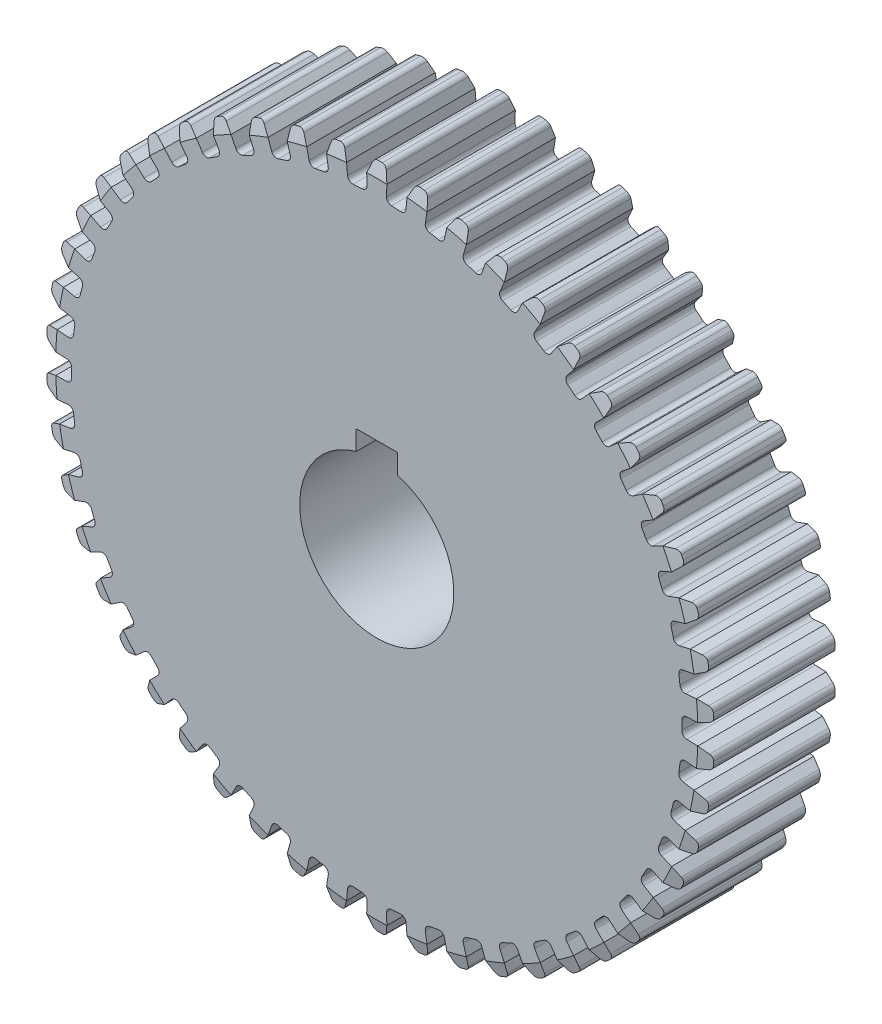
SolidWorks part; units mm, degrees
ref_plane "Front X-Y" through (0, 0, 0) normal (0, 0, 1) x (1, 0, 0)
ref_plane "Top X-Z" through (0, 0, 0) normal (0, 1, 0) x (1, 0, 0)
ref_plane "Right Y-Z" through (0, 0, 0) normal (1, 0, 0) x (0, 0, -1)
ref_plane "Plane1" through (0, 0, 0) normal (1, 0, 0) x (0, 0, -1)
sketch "Sketch1" plane through (0, 0, 0) normal (1, 0, 0) x (0, 0, -1)
  line L0 (-34, 15.3) -> (-33.7, 15)
  line L1 (-33.7, 15) -> (-0.3, 15)
  line L2 (-0.3, 15) -> (0, 15.3)
  line L3 (0, 15.3) -> (0, 62.5)
  line L4 (0, 62.5) -> (-1.2058, 67)
  line L5 (-1.2058, 67) -> (-23.7942, 67)
  line L6 (-23.7942, 67) -> (-25, 62.5)
  line L7 (-25, 62.5) -> (-25, 22)
  line L8 (-25, 22) -> (-33.5, 22)
  line L9 (-33.5, 22) -> (-34, 21.5)
  line L10 (-34, 21.5) -> (-34, 15.3)
  line L11 (0, 0) -> (-34, 0) construction
revolve "Revolve1" add sketch "Sketch1" angle 360 about L11
ref_plane "Plane2" through (0, 0, 0) normal (0, 0, 1) x (1, 0, 0)
sketch "Sketch2" plane through (0, 0, 0) normal (0, 0, 1) x (1, 0, 0)
  line L0 (-64.0989, -5.393) -> (-62.2226, -5.8818)
  line L1 (-62.2226, -5.8818) -> (-60.0988, -5.681)
  line L2 (-59.6235, -9.4434) -> (-61.7305, -9.7772)
  line L3 (-61.7305, -9.7772) -> (-63.4263, -10.7171)
  line L4 (-62.9175, -13.3842) -> (-60.9948, -13.634)
  line L5 (-60.9948, -13.634) -> (-58.9129, -13.1686)
  line L6 (-57.9698, -16.8418) -> (-60.0184, -17.4369)
  line L7 (-60.0184, -17.4369) -> (-61.583, -18.5821)
  line L8 (-60.7439, -21.1644) -> (-58.805, -21.1711)
  line L9 (-58.805, -21.1711) -> (-56.7979, -20.4485)
  line L10 (-55.4018, -23.9745) -> (-57.3597, -24.8217)
  line L11 (-57.3597, -24.8217) -> (-58.7684, -26.1539)
  line L12 (-57.6123, -28.6107) -> (-55.6879, -28.3744)
  line L13 (-55.6879, -28.3744) -> (-53.7871, -27.4059)
  line L14 (-51.9602, -30.7292) -> (-53.7964, -31.8151)
  line L15 (-53.7964, -31.8151) -> (-55.027, -33.3133)
  line L16 (-53.5722, -35.6058) -> (-51.6925, -35.1302)
  line L17 (-51.6925, -35.1302) -> (-49.9281, -33.9311)
  line L18 (-47.6991, -36.9992) -> (-49.3847, -38.3067)
  line L19 (-49.3847, -38.3067) -> (-50.4179, -39.9474)
  line L20 (-48.6871, -42.0394) -> (-46.8819, -41.332)
  line L21 (-46.8819, -41.332) -> (-45.2817, -39.9212)
  line L22 (-42.6857, -42.6857) -> (-44.1942, -44.1942)
  line L23 (-44.1942, -44.1942) -> (-45.0136, -45.9514)
  line L24 (-43.0343, -47.8101) -> (-41.332, -46.8819)
  line L25 (-41.332, -46.8819) -> (-39.9212, -45.2817)
  line L26 (-36.9992, -47.6991) -> (-38.3067, -49.3847)
  line L27 (-38.3067, -49.3847) -> (-38.8994, -51.2307)
  line L28 (-36.7028, -52.8267) -> (-35.1302, -51.6925)
  line L29 (-35.1302, -51.6925) -> (-33.9311, -49.9281)
  line L30 (-30.7292, -51.9602) -> (-31.8151, -53.7964)
  line L31 (-31.8151, -53.7964) -> (-32.1717, -55.7022)
  line L32 (-29.7924, -57.0102) -> (-28.3744, -55.6879)
  line L33 (-28.3744, -55.6879) -> (-27.4059, -53.7871)
  line L34 (-23.9745, -55.4018) -> (-24.8217, -57.3597)
  line L35 (-24.8217, -57.3597) -> (-24.9367, -59.2951)
  line L36 (-22.4122, -60.2947) -> (-21.1711, -58.805)
  line L37 (-21.1711, -58.805) -> (-20.4485, -56.7979)
  line L38 (-16.8418, -57.9698) -> (-17.4369, -60.0184)
  line L39 (-17.4369, -60.0184) -> (-17.3084, -61.953)
  line L40 (-14.6786, -62.6282) -> (-13.634, -60.9948)
  line L41 (-13.634, -60.9948) -> (-13.1686, -58.9129)
  line L42 (-9.4434, -59.6235) -> (-9.7772, -61.7305)
  line L43 (-9.7772, -61.7305) -> (-9.4072, -63.6338)
  line L44 (-6.7134, -63.9741) -> (-5.8818, -62.2226)
  line L45 (-5.8818, -62.2226) -> (-5.681, -60.0988)
  line L46 (-1.8962, -60.3369) -> (-1.9632, -62.4692)
  line L47 (-1.9632, -62.4692) -> (-1.3576, -64.311)
  line L48 (1.3576, -64.311) -> (1.9632, -62.4692)
  line L49 (1.9632, -62.4692) -> (1.8962, -60.3369)
  line L50 (5.681, -60.0988) -> (5.8818, -62.2226)
  line L51 (5.8818, -62.2226) -> (6.7134, -63.9741)
  line L52 (9.4072, -63.6338) -> (9.7772, -61.7305)
  line L53 (9.7772, -61.7305) -> (9.4434, -59.6235)
  line L54 (13.1686, -58.9129) -> (13.634, -60.9948)
  line L55 (13.634, -60.9948) -> (14.6786, -62.6282)
  line L56 (17.3084, -61.953) -> (17.4369, -60.0184)
  line L57 (17.4369, -60.0184) -> (16.8418, -57.9698)
  line L58 (20.4485, -56.7979) -> (21.1711, -58.805)
  line L59 (21.1711, -58.805) -> (22.4122, -60.2947)
  line L60 (24.9367, -59.2951) -> (24.8217, -57.3597)
  line L61 (24.8217, -57.3597) -> (23.9745, -55.4018)
  line L62 (27.4059, -53.7871) -> (28.3744, -55.6879)
  line L63 (28.3744, -55.6879) -> (29.7924, -57.0102)
  line L64 (32.1717, -55.7022) -> (31.8151, -53.7964)
  line L65 (31.8151, -53.7964) -> (30.7292, -51.9602)
  line L66 (33.9311, -49.9281) -> (35.1302, -51.6925)
  line L67 (35.1302, -51.6925) -> (36.7028, -52.8267)
  line L68 (38.8994, -51.2307) -> (38.3067, -49.3847)
  line L69 (38.3067, -49.3847) -> (36.9992, -47.6991)
  line L70 (39.9212, -45.2817) -> (41.332, -46.8819)
  line L71 (41.332, -46.8819) -> (43.0343, -47.8101)
  line L72 (45.0136, -45.9514) -> (44.1942, -44.1942)
  line L73 (44.1942, -44.1942) -> (42.6857, -42.6857)
  line L74 (45.2817, -39.9212) -> (46.8819, -41.332)
  line L75 (46.8819, -41.332) -> (48.6871, -42.0394)
  line L76 (50.4179, -39.9474) -> (49.3847, -38.3067)
  line L77 (49.3847, -38.3067) -> (47.6991, -36.9992)
  line L78 (49.9281, -33.9311) -> (51.6925, -35.1302)
  line L79 (51.6925, -35.1302) -> (53.5722, -35.6058)
  line L80 (55.027, -33.3133) -> (53.7964, -31.8151)
  line L81 (53.7964, -31.8151) -> (51.9602, -30.7292)
  line L82 (53.7871, -27.4059) -> (55.6879, -28.3744)
  line L83 (55.6879, -28.3744) -> (57.6123, -28.6107)
  line L84 (58.7684, -26.1539) -> (57.3597, -24.8217)
  line L85 (57.3597, -24.8217) -> (55.4018, -23.9745)
  line L86 (56.7979, -20.4485) -> (58.805, -21.1711)
  line L87 (58.805, -21.1711) -> (60.7439, -21.1644)
  line L88 (61.583, -18.5821) -> (60.0184, -17.4369)
  line L89 (60.0184, -17.4369) -> (57.9698, -16.8418)
  line L90 (58.9129, -13.1686) -> (60.9948, -13.634)
  line L91 (60.9948, -13.634) -> (62.9175, -13.3842)
  line L92 (63.4263, -10.7171) -> (61.7305, -9.7772)
  line L93 (61.7305, -9.7772) -> (59.6235, -9.4434)
  line L94 (60.0988, -5.681) -> (62.2226, -5.8818)
  line L95 (62.2226, -5.8818) -> (64.0989, -5.393)
  line L96 (64.2694, -2.6832) -> (62.4692, -1.9632)
  line L97 (62.4692, -1.9632) -> (60.3369, -1.8962)
  line L98 (60.3369, 1.8962) -> (62.4692, 1.9632)
  line L99 (62.4692, 1.9632) -> (64.2694, 2.6832)
  line L100 (64.0989, 5.393) -> (62.2226, 5.8818)
  line L101 (62.2226, 5.8818) -> (60.0988, 5.681)
  line L102 (59.6235, 9.4434) -> (61.7305, 9.7772)
  line L103 (61.7305, 9.7772) -> (63.4263, 10.7171)
  line L104 (62.9175, 13.3842) -> (60.9948, 13.634)
  line L105 (60.9948, 13.634) -> (58.9129, 13.1686)
  line L106 (57.9698, 16.8418) -> (60.0184, 17.4369)
  line L107 (60.0184, 17.4369) -> (61.583, 18.5821)
  line L108 (60.7439, 21.1644) -> (58.805, 21.1711)
  line L109 (58.805, 21.1711) -> (56.7979, 20.4485)
  line L110 (55.4018, 23.9745) -> (57.3597, 24.8217)
  line L111 (57.3597, 24.8217) -> (58.7684, 26.1539)
  line L112 (57.6123, 28.6107) -> (55.6879, 28.3744)
  line L113 (55.6879, 28.3744) -> (53.7871, 27.4059)
  line L114 (51.9602, 30.7292) -> (53.7964, 31.8151)
  line L115 (53.7964, 31.8151) -> (55.027, 33.3133)
  line L116 (53.5722, 35.6058) -> (51.6925, 35.1302)
  line L117 (51.6925, 35.1302) -> (49.9281, 33.9311)
  line L118 (47.6991, 36.9992) -> (49.3847, 38.3067)
  line L119 (49.3847, 38.3067) -> (50.4179, 39.9474)
  line L120 (48.6871, 42.0394) -> (46.8819, 41.332)
  line L121 (46.8819, 41.332) -> (45.2817, 39.9212)
  line L122 (42.6857, 42.6857) -> (44.1942, 44.1942)
  line L123 (44.1942, 44.1942) -> (45.0136, 45.9514)
  line L124 (43.0343, 47.8101) -> (41.332, 46.8819)
  line L125 (41.332, 46.8819) -> (39.9212, 45.2817)
  line L126 (36.9992, 47.6991) -> (38.3067, 49.3847)
  line L127 (38.3067, 49.3847) -> (38.8994, 51.2307)
  line L128 (36.7028, 52.8267) -> (35.1302, 51.6925)
  line L129 (35.1302, 51.6925) -> (33.9311, 49.9281)
  line L130 (30.7292, 51.9602) -> (31.8151, 53.7964)
  line L131 (31.8151, 53.7964) -> (32.1717, 55.7022)
  line L132 (29.7924, 57.0102) -> (28.3744, 55.6879)
  line L133 (28.3744, 55.6879) -> (27.4059, 53.7871)
  line L134 (23.9745, 55.4018) -> (24.8217, 57.3597)
  line L135 (24.8217, 57.3597) -> (24.9367, 59.2951)
  line L136 (22.4122, 60.2947) -> (21.1711, 58.805)
  line L137 (21.1711, 58.805) -> (20.4485, 56.7979)
  line L138 (16.8418, 57.9698) -> (17.4369, 60.0184)
  line L139 (17.4369, 60.0184) -> (17.3084, 61.953)
  line L140 (14.6786, 62.6282) -> (13.634, 60.9948)
  line L141 (13.634, 60.9948) -> (13.1686, 58.9129)
  line L142 (9.4434, 59.6235) -> (9.7772, 61.7305)
  line L143 (9.7772, 61.7305) -> (9.4072, 63.6338)
  line L144 (6.7134, 63.9741) -> (5.8818, 62.2226)
  line L145 (5.8818, 62.2226) -> (5.681, 60.0988)
  line L146 (1.8962, 60.3369) -> (1.9632, 62.4692)
  line L147 (1.9632, 62.4692) -> (1.3576, 64.311)
  line L148 (-1.3576, 64.311) -> (-1.9632, 62.4692)
  line L149 (-1.9632, 62.4692) -> (-1.8962, 60.3369)
  line L150 (-5.681, 60.0988) -> (-5.8818, 62.2226)
  line L151 (-5.8818, 62.2226) -> (-6.7134, 63.9741)
  line L152 (-9.4072, 63.6338) -> (-9.7772, 61.7305)
  line L153 (-9.7772, 61.7305) -> (-9.4434, 59.6235)
  line L154 (-13.1686, 58.9129) -> (-13.634, 60.9948)
  line L155 (-13.634, 60.9948) -> (-14.6786, 62.6282)
  line L156 (-17.3084, 61.953) -> (-17.4369, 60.0184)
  line L157 (-17.4369, 60.0184) -> (-16.8418, 57.9698)
  line L158 (-20.4485, 56.7979) -> (-21.1711, 58.805)
  line L159 (-21.1711, 58.805) -> (-22.4122, 60.2947)
  line L160 (-24.9367, 59.2951) -> (-24.8217, 57.3597)
  line L161 (-24.8217, 57.3597) -> (-23.9745, 55.4018)
  line L162 (-27.4059, 53.7871) -> (-28.3744, 55.6879)
  line L163 (-28.3744, 55.6879) -> (-29.7924, 57.0102)
  line L164 (-32.1717, 55.7022) -> (-31.8151, 53.7964)
  line L165 (-31.8151, 53.7964) -> (-30.7292, 51.9602)
  line L166 (-33.9311, 49.9281) -> (-35.1302, 51.6925)
  line L167 (-35.1302, 51.6925) -> (-36.7028, 52.8267)
  line L168 (-38.8994, 51.2307) -> (-38.3067, 49.3847)
  line L169 (-38.3067, 49.3847) -> (-36.9992, 47.6991)
  line L170 (-39.9212, 45.2817) -> (-41.332, 46.8819)
  line L171 (-41.332, 46.8819) -> (-43.0343, 47.8101)
  line L172 (-45.0136, 45.9514) -> (-44.1942, 44.1942)
  line L173 (-44.1942, 44.1942) -> (-42.6857, 42.6857)
  line L174 (-45.2817, 39.9212) -> (-46.8819, 41.332)
  line L175 (-46.8819, 41.332) -> (-48.6871, 42.0394)
  line L176 (-50.4179, 39.9474) -> (-49.3847, 38.3067)
  line L177 (-49.3847, 38.3067) -> (-47.6991, 36.9992)
  line L178 (-49.9281, 33.9311) -> (-51.6925, 35.1302)
  line L179 (-51.6925, 35.1302) -> (-53.5722, 35.6058)
  line L180 (-55.027, 33.3133) -> (-53.7964, 31.8151)
  line L181 (-53.7964, 31.8151) -> (-51.9602, 30.7292)
  line L182 (-53.7871, 27.4059) -> (-55.6879, 28.3744)
  line L183 (-55.6879, 28.3744) -> (-57.6123, 28.6107)
  line L184 (-58.7684, 26.1539) -> (-57.3597, 24.8217)
  line L185 (-57.3597, 24.8217) -> (-55.4018, 23.9745)
  line L186 (-56.7979, 20.4485) -> (-58.805, 21.1711)
  line L187 (-58.805, 21.1711) -> (-60.7439, 21.1644)
  line L188 (-61.583, 18.5821) -> (-60.0184, 17.4369)
  line L189 (-60.0184, 17.4369) -> (-57.9698, 16.8418)
  line L190 (-58.9129, 13.1686) -> (-60.9948, 13.634)
  line L191 (-60.9948, 13.634) -> (-62.9175, 13.3842)
  line L192 (-63.4263, 10.7171) -> (-61.7305, 9.7772)
  line L193 (-61.7305, 9.7772) -> (-59.6235, 9.4434)
  line L194 (-60.0988, 5.681) -> (-62.2226, 5.8818)
  line L195 (-62.2226, 5.8818) -> (-64.0989, 5.393)
  line L196 (-64.2694, 2.6832) -> (-62.4692, 1.9632)
  line L197 (-62.4692, 1.9632) -> (-60.3369, 1.8962)
  line L198 (-60.3369, -1.8962) -> (-62.4692, -1.9632)
  line L199 (-62.4692, -1.9632) -> (-64.2694, -2.6832)
  circle A0 centre (0, 0) radius 70
  arc A1 (-64.2694, -2.6832) -> (-64.8964, -3.6681) centre (-63.898, -3.6117) ccw
  arc A2 (-64.8964, -3.6681) -> (-64.8444, -4.4945) centre (0, 0) ccw
  arc A3 (-64.8444, -4.4945) -> (-64.0989, -5.393) centre (-63.8468, -4.4253) ccw
  arc A4 (-60.0988, -5.681) -> (-59.0108, -6.566) centre (-60.0047, -6.6766) cw
  arc A5 (-59.0108, -6.566) -> (-58.7898, -8.3157) centre (0, 0) ccw
  arc A6 (-58.7898, -8.3157) -> (-59.6235, -9.4434) centre (-59.7799, -8.4557) cw
  arc A7 (-63.4263, -10.7171) -> (-63.925, -11.7729) centre (-62.9415, -11.5918) ccw
  arc A8 (-63.925, -11.7729) -> (-63.7698, -12.5862) centre (0, 0) ccw
  arc A9 (-63.7698, -12.5862) -> (-62.9175, -13.3842) centre (-62.7887, -12.3926) ccw
  arc A10 (-58.9129, -13.1686) -> (-57.7226, -13.9102) centre (-58.6947, -14.1445) cw
  arc A11 (-57.7226, -13.9102) -> (-57.284, -15.6184) centre (0, 0) ccw
  arc A12 (-57.284, -15.6184) -> (-57.9698, -16.8418) centre (-58.2488, -15.8815) cw
  arc A13 (-61.583, -18.5821) -> (-61.9454, -19.692) centre (-60.9923, -19.389) ccw
  arc A14 (-61.9454, -19.692) -> (-61.6895, -20.4794) centre (0, 0) ccw
  arc A15 (-61.6895, -20.4794) -> (-60.7439, -21.1644) centre (-60.7404, -20.1644) ccw
  arc A16 (-56.7979, -20.4485) -> (-55.524, -21.0351) centre (-56.4591, -21.3894) cw
  arc A17 (-55.524, -21.0351) -> (-54.8748, -22.6749) centre (0, 0) ccw
  arc A18 (-54.8748, -22.6749) -> (-55.4018, -23.9745) centre (-55.799, -23.0568) cw
  arc A19 (-58.7684, -26.1539) -> (-58.9888, -27.3005) centre (-58.0813, -26.8805) ccw
  arc A20 (-58.9888, -27.3005) -> (-58.6363, -28.0497) centre (0, 0) ccw
  arc A21 (-58.6363, -28.0497) -> (-57.6123, -28.6107) centre (-57.7342, -27.6181) ccw
  arc A22 (-53.7871, -27.4059) -> (-52.4498, -27.8282) centre (-53.3331, -28.2969) cw
  arc A23 (-52.4498, -27.8282) -> (-51.6002, -29.3737) centre (0, 0) ccw
  arc A24 (-51.6002, -29.3737) -> (-51.9602, -30.7292) centre (-52.4692, -29.8684) cw
  arc A25 (-55.027, -33.3133) -> (-55.102, -34.4785) centre (-54.2543, -33.9481) ccw
  arc A26 (-55.102, -34.4785) -> (-54.6584, -35.1776) centre (0, 0) ccw
  arc A27 (-54.6584, -35.1776) -> (-53.5722, -35.6058) centre (-53.8175, -34.6364) ccw
  arc A28 (-49.9281, -33.9311) -> (-48.5484, -34.1825) centre (-49.3661, -34.7582) cw
  arc A29 (-48.5484, -34.1825) -> (-47.5118, -35.6093) centre (0, 0) ccw
  arc A30 (-47.5118, -35.6093) -> (-47.6991, -36.9992) centre (-48.312, -36.209) cw
  arc A31 (-50.4179, -39.9474) -> (-50.3462, -41.1127) centre (-49.5717, -40.4802) ccw
  arc A32 (-50.3462, -41.1127) -> (-49.8185, -41.7507) centre (0, 0) ccw
  arc A33 (-49.8185, -41.7507) -> (-48.6871, -42.0394) centre (-49.052, -41.1084) ccw
  arc A34 (-45.2817, -39.9212) -> (-43.8814, -39.9977) centre (-44.6204, -40.6713) cw
  arc A35 (-43.8814, -39.9977) -> (-42.6741, -41.2833) centre (0, 0) ccw
  arc A36 (-42.6741, -41.2833) -> (-42.6857, -42.6857) centre (-43.3928, -41.9786) cw
  arc A37 (-45.0136, -45.9514) -> (-44.7964, -47.0986) centre (-44.1073, -46.374) ccw
  arc A38 (-44.7964, -47.0986) -> (-44.1929, -47.6654) centre (0, 0) ccw
  arc A39 (-44.1929, -47.6654) -> (-43.0343, -47.8101) centre (-43.513, -46.9321) ccw
  arc A40 (-39.9212, -45.2817) -> (-38.5223, -45.1821) centre (-39.1711, -45.9431) cw
  arc A41 (-38.5223, -45.1821) -> (-37.1634, -46.3063) centre (0, 0) ccw
  arc A42 (-37.1634, -46.3063) -> (-36.9992, -47.6991) centre (-37.7893, -47.0862) cw
  arc A43 (-38.8994, -51.2307) -> (-38.5402, -52.3417) centre (-37.9473, -51.5364) ccw
  arc A44 (-38.5402, -52.3417) -> (-37.8703, -52.8284) centre (0, 0) ccw
  arc A45 (-37.8703, -52.8284) -> (-36.7028, -52.8267) centre (-37.2877, -52.0156) ccw
  arc A46 (-33.9311, -49.9281) -> (-32.5557, -49.6539) centre (-33.104, -50.4902) cw
  arc A47 (-32.5557, -49.6539) -> (-31.0667, -50.5989) centre (0, 0) ccw
  arc A48 (-31.0667, -50.5989) -> (-30.7292, -51.9602) centre (-31.5899, -51.4511) cw
  arc A49 (-32.1717, -55.7022) -> (-31.6761, -56.7593) centre (-31.1888, -55.8861) ccw
  arc A50 (-31.6761, -56.7593) -> (-30.9506, -57.1582) centre (0, 0) ccw
  arc A51 (-30.9506, -57.1582) -> (-29.7924, -57.0102) centre (-30.4744, -56.2789) ccw
  arc A52 (-27.4059, -53.7871) -> (-26.0757, -53.3427) centre (-26.5149, -54.2411) cw
  arc A53 (-26.0757, -53.3427) -> (-24.48, -54.0936) centre (0, 0) ccw
  arc A54 (-24.48, -54.0936) -> (-23.9745, -55.4018) centre (-24.8923, -55.0047) cw
  arc A55 (-24.9367, -59.2951) -> (-24.3125, -60.2818) centre (-23.9385, -59.3544) ccw
  arc A56 (-24.3125, -60.2818) -> (-23.5427, -60.5866) centre (0, 0) ccw
  arc A57 (-23.5427, -60.5866) -> (-22.4122, -60.2947) centre (-23.1805, -59.6545) ccw
  arc A58 (-20.4485, -56.7979) -> (-19.1845, -56.1903) centre (-19.5076, -57.1366) cw
  arc A59 (-19.1845, -56.1903) -> (-17.5072, -56.7352) centre (0, 0) ccw
  arc A60 (-17.5072, -56.7352) -> (-16.8418, -57.9698) centre (-17.8021, -57.6908) cw
  arc A61 (-17.3084, -61.953) -> (-16.5655, -62.8537) centre (-16.3106, -61.8867) ccw
  arc A62 (-16.5655, -62.8537) -> (-15.7635, -63.0596) centre (0, 0) ccw
  arc A63 (-15.7635, -63.0596) -> (-14.6786, -62.6282) centre (-15.521, -62.0894) ccw
  arc A64 (-13.1686, -58.9129) -> (-11.9907, -58.1516) centre (-12.1927, -59.131) cw
  arc A65 (-11.9907, -58.1516) -> (-10.2584, -58.4821) centre (0, 0) ccw
  arc A66 (-10.2584, -58.4821) -> (-9.4434, -59.6235) centre (-10.4311, -59.4671) cw
  arc A67 (-9.4072, -63.6338) -> (-8.5572, -64.4343) centre (-8.4256, -63.443) ccw
  arc A68 (-8.5572, -64.4343) -> (-7.7358, -64.538) centre (0, 0) ccw
  arc A69 (-7.7358, -64.538) -> (-6.7134, -63.9741) centre (-7.6168, -63.5451) ccw
  arc A70 (-5.681, -60.0988) -> (-4.6078, -59.1959) centre (-4.6854, -60.1929) cw
  arc A71 (-4.6078, -59.1959) -> (-2.8477, -59.3067) centre (0, 0) ccw
  arc A72 (-2.8477, -59.3067) -> (-1.8962, -60.3369) centre (-2.8957, -60.3055) cw
  arc A73 (-1.3576, -64.311) -> (-0.414, -64.9987) centre (-0.4076, -63.9987) ccw
  arc A74 (-0.414, -64.9987) -> (0.414, -64.9987) centre (0, 0) ccw
  arc A75 (0.414, -64.9987) -> (1.3576, -64.311) centre (0.4076, -63.9987) ccw
  arc A76 (1.8962, -60.3369) -> (2.8477, -59.3067) centre (2.8957, -60.3055) cw
  arc A77 (2.8477, -59.3067) -> (4.6078, -59.1959) centre (0, 0) ccw
  arc A78 (4.6078, -59.1959) -> (5.681, -60.0988) centre (4.6854, -60.1929) cw
  arc A79 (6.7134, -63.9741) -> (7.7358, -64.538) centre (7.6168, -63.5451) ccw
  arc A80 (7.7358, -64.538) -> (8.5572, -64.4343) centre (0, 0) ccw
  arc A81 (8.5572, -64.4343) -> (9.4072, -63.6338) centre (8.4256, -63.443) ccw
  arc A82 (9.4434, -59.6235) -> (10.2584, -58.4821) centre (10.4311, -59.4671) cw
  arc A83 (10.2584, -58.4821) -> (11.9907, -58.1516) centre (0, 0) ccw
  arc A84 (11.9907, -58.1516) -> (13.1686, -58.9129) centre (12.1927, -59.131) cw
  arc A85 (14.6786, -62.6282) -> (15.7635, -63.0596) centre (15.521, -62.0894) ccw
  arc A86 (15.7635, -63.0596) -> (16.5655, -62.8537) centre (0, 0) ccw
  arc A87 (16.5655, -62.8537) -> (17.3084, -61.953) centre (16.3106, -61.8867) ccw
  arc A88 (16.8418, -57.9698) -> (17.5072, -56.7352) centre (17.8021, -57.6908) cw
  arc A89 (17.5072, -56.7352) -> (19.1845, -56.1903) centre (0, 0) ccw
  arc A90 (19.1845, -56.1903) -> (20.4485, -56.7979) centre (19.5076, -57.1366) cw
  arc A91 (22.4122, -60.2947) -> (23.5427, -60.5866) centre (23.1805, -59.6545) ccw
  arc A92 (23.5427, -60.5866) -> (24.3125, -60.2818) centre (0, 0) ccw
  arc A93 (24.3125, -60.2818) -> (24.9367, -59.2951) centre (23.9385, -59.3544) ccw
  arc A94 (23.9745, -55.4018) -> (24.48, -54.0936) centre (24.8923, -55.0047) cw
  arc A95 (24.48, -54.0936) -> (26.0757, -53.3427) centre (0, 0) ccw
  arc A96 (26.0757, -53.3427) -> (27.4059, -53.7871) centre (26.5149, -54.2411) cw
  arc A97 (29.7924, -57.0102) -> (30.9506, -57.1582) centre (30.4744, -56.2789) ccw
  arc A98 (30.9506, -57.1582) -> (31.6761, -56.7593) centre (0, 0) ccw
  arc A99 (31.6761, -56.7593) -> (32.1717, -55.7022) centre (31.1888, -55.8861) ccw
  arc A100 (30.7292, -51.9602) -> (31.0667, -50.5989) centre (31.5899, -51.4511) cw
  arc A101 (31.0667, -50.5989) -> (32.5557, -49.6539) centre (0, 0) ccw
  arc A102 (32.5557, -49.6539) -> (33.9311, -49.9281) centre (33.104, -50.4902) cw
  arc A103 (36.7028, -52.8267) -> (37.8703, -52.8284) centre (37.2877, -52.0156) ccw
  arc A104 (37.8703, -52.8284) -> (38.5402, -52.3417) centre (0, 0) ccw
  arc A105 (38.5402, -52.3417) -> (38.8994, -51.2307) centre (37.9473, -51.5364) ccw
  arc A106 (36.9992, -47.6991) -> (37.1634, -46.3063) centre (37.7893, -47.0862) cw
  arc A107 (37.1634, -46.3063) -> (38.5223, -45.1821) centre (0, 0) ccw
  arc A108 (38.5223, -45.1821) -> (39.9212, -45.2817) centre (39.1711, -45.9431) cw
  arc A109 (43.0343, -47.8101) -> (44.1929, -47.6654) centre (43.513, -46.9321) ccw
  arc A110 (44.1929, -47.6654) -> (44.7964, -47.0986) centre (0, 0) ccw
  arc A111 (44.7964, -47.0986) -> (45.0136, -45.9514) centre (44.1073, -46.374) ccw
  arc A112 (42.6857, -42.6857) -> (42.6741, -41.2833) centre (43.3928, -41.9786) cw
  arc A113 (42.6741, -41.2833) -> (43.8814, -39.9977) centre (0, 0) ccw
  arc A114 (43.8814, -39.9977) -> (45.2817, -39.9212) centre (44.6204, -40.6713) cw
  arc A115 (48.6871, -42.0394) -> (49.8185, -41.7507) centre (49.052, -41.1084) ccw
  arc A116 (49.8185, -41.7507) -> (50.3462, -41.1127) centre (0, 0) ccw
  arc A117 (50.3462, -41.1127) -> (50.4179, -39.9474) centre (49.5717, -40.4802) ccw
  arc A118 (47.6991, -36.9992) -> (47.5118, -35.6093) centre (48.312, -36.209) cw
  arc A119 (47.5118, -35.6093) -> (48.5484, -34.1825) centre (0, 0) ccw
  arc A120 (48.5484, -34.1825) -> (49.9281, -33.9311) centre (49.3661, -34.7582) cw
  arc A121 (53.5722, -35.6058) -> (54.6584, -35.1776) centre (53.8175, -34.6364) ccw
  arc A122 (54.6584, -35.1776) -> (55.102, -34.4785) centre (0, 0) ccw
  arc A123 (55.102, -34.4785) -> (55.027, -33.3133) centre (54.2543, -33.9481) ccw
  arc A124 (51.9602, -30.7292) -> (51.6002, -29.3737) centre (52.4692, -29.8684) cw
  arc A125 (51.6002, -29.3737) -> (52.4498, -27.8282) centre (0, 0) ccw
  arc A126 (52.4498, -27.8282) -> (53.7871, -27.4059) centre (53.3331, -28.2969) cw
  arc A127 (57.6123, -28.6107) -> (58.6363, -28.0497) centre (57.7342, -27.6181) ccw
  arc A128 (58.6363, -28.0497) -> (58.9888, -27.3005) centre (0, 0) ccw
  arc A129 (58.9888, -27.3005) -> (58.7684, -26.1539) centre (58.0813, -26.8805) ccw
  arc A130 (55.4018, -23.9745) -> (54.8748, -22.6749) centre (55.799, -23.0568) cw
  arc A131 (54.8748, -22.6749) -> (55.524, -21.0351) centre (0, 0) ccw
  arc A132 (55.524, -21.0351) -> (56.7979, -20.4485) centre (56.4591, -21.3894) cw
  arc A133 (60.7439, -21.1644) -> (61.6895, -20.4794) centre (60.7404, -20.1644) ccw
  arc A134 (61.6895, -20.4794) -> (61.9454, -19.692) centre (0, 0) ccw
  arc A135 (61.9454, -19.692) -> (61.583, -18.5821) centre (60.9923, -19.389) ccw
  arc A136 (57.9698, -16.8418) -> (57.284, -15.6184) centre (58.2488, -15.8815) cw
  arc A137 (57.284, -15.6184) -> (57.7226, -13.9102) centre (0, 0) ccw
  arc A138 (57.7226, -13.9102) -> (58.9129, -13.1686) centre (58.6947, -14.1445) cw
  arc A139 (62.9175, -13.3842) -> (63.7698, -12.5862) centre (62.7887, -12.3926) ccw
  arc A140 (63.7698, -12.5862) -> (63.925, -11.7729) centre (0, 0) ccw
  arc A141 (63.925, -11.7729) -> (63.4263, -10.7171) centre (62.9415, -11.5918) ccw
  arc A142 (59.6235, -9.4434) -> (58.7898, -8.3157) centre (59.7799, -8.4557) cw
  arc A143 (58.7898, -8.3157) -> (59.0108, -6.566) centre (0, 0) ccw
  arc A144 (59.0108, -6.566) -> (60.0988, -5.681) centre (60.0047, -6.6766) cw
  arc A145 (64.0989, -5.393) -> (64.8444, -4.4945) centre (63.8468, -4.4253) ccw
  arc A146 (64.8444, -4.4945) -> (64.8964, -3.6681) centre (0, 0) ccw
  arc A147 (64.8964, -3.6681) -> (64.2694, -2.6832) centre (63.898, -3.6117) ccw
  arc A148 (60.3369, -1.8962) -> (59.3685, -0.8818) centre (60.3683, -0.8967) cw
  arc A149 (59.3685, -0.8818) -> (59.3685, 0.8818) centre (0, 0) ccw
  arc A150 (59.3685, 0.8818) -> (60.3369, 1.8962) centre (60.3683, 0.8967) cw
  arc A151 (64.2694, 2.6832) -> (64.8964, 3.6681) centre (63.898, 3.6117) ccw
  arc A152 (64.8964, 3.6681) -> (64.8444, 4.4945) centre (0, 0) ccw
  arc A153 (64.8444, 4.4945) -> (64.0989, 5.393) centre (63.8468, 4.4253) ccw
  arc A154 (60.0988, 5.681) -> (59.0108, 6.566) centre (60.0047, 6.6766) cw
  arc A155 (59.0108, 6.566) -> (58.7898, 8.3157) centre (0, 0) ccw
  arc A156 (58.7898, 8.3157) -> (59.6235, 9.4434) centre (59.7799, 8.4557) cw
  arc A157 (63.4263, 10.7171) -> (63.925, 11.7729) centre (62.9415, 11.5918) ccw
  arc A158 (63.925, 11.7729) -> (63.7698, 12.5862) centre (0, 0) ccw
  arc A159 (63.7698, 12.5862) -> (62.9175, 13.3842) centre (62.7887, 12.3926) ccw
  arc A160 (58.9129, 13.1686) -> (57.7226, 13.9102) centre (58.6947, 14.1445) cw
  arc A161 (57.7226, 13.9102) -> (57.284, 15.6184) centre (0, 0) ccw
  arc A162 (57.284, 15.6184) -> (57.9698, 16.8418) centre (58.2488, 15.8815) cw
  arc A163 (61.583, 18.5821) -> (61.9453, 19.692) centre (60.9923, 19.389) ccw
  arc A164 (61.9453, 19.692) -> (61.6895, 20.4794) centre (0, 0) ccw
  arc A165 (61.6895, 20.4794) -> (60.7439, 21.1644) centre (60.7404, 20.1644) ccw
  arc A166 (56.7979, 20.4485) -> (55.524, 21.0351) centre (56.4591, 21.3894) cw
  arc A167 (55.524, 21.0351) -> (54.8748, 22.6749) centre (0, 0) ccw
  arc A168 (54.8748, 22.6749) -> (55.4018, 23.9745) centre (55.799, 23.0568) cw
  arc A169 (58.7684, 26.1539) -> (58.9888, 27.3005) centre (58.0813, 26.8805) ccw
  arc A170 (58.9888, 27.3005) -> (58.6363, 28.0497) centre (0, 0) ccw
  arc A171 (58.6363, 28.0497) -> (57.6123, 28.6107) centre (57.7342, 27.6181) ccw
  arc A172 (53.7871, 27.4059) -> (52.4498, 27.8282) centre (53.3331, 28.2969) cw
  arc A173 (52.4498, 27.8282) -> (51.6002, 29.3737) centre (0, 0) ccw
  arc A174 (51.6002, 29.3737) -> (51.9602, 30.7292) centre (52.4692, 29.8684) cw
  arc A175 (55.027, 33.3133) -> (55.102, 34.4785) centre (54.2543, 33.9481) ccw
  arc A176 (55.102, 34.4785) -> (54.6584, 35.1776) centre (0, 0) ccw
  arc A177 (54.6584, 35.1776) -> (53.5722, 35.6058) centre (53.8175, 34.6364) ccw
  arc A178 (49.9281, 33.9311) -> (48.5484, 34.1825) centre (49.3661, 34.7582) cw
  arc A179 (48.5484, 34.1825) -> (47.5118, 35.6093) centre (0, 0) ccw
  arc A180 (47.5118, 35.6093) -> (47.6991, 36.9992) centre (48.312, 36.209) cw
  arc A181 (50.4179, 39.9474) -> (50.3462, 41.1127) centre (49.5717, 40.4802) ccw
  arc A182 (50.3462, 41.1127) -> (49.8185, 41.7507) centre (0, 0) ccw
  arc A183 (49.8185, 41.7507) -> (48.6871, 42.0394) centre (49.052, 41.1084) ccw
  arc A184 (45.2817, 39.9212) -> (43.8814, 39.9977) centre (44.6204, 40.6713) cw
  arc A185 (43.8814, 39.9977) -> (42.6741, 41.2833) centre (0, 0) ccw
  arc A186 (42.6741, 41.2833) -> (42.6857, 42.6857) centre (43.3928, 41.9786) cw
  arc A187 (45.0136, 45.9514) -> (44.7964, 47.0986) centre (44.1073, 46.374) ccw
  arc A188 (44.7964, 47.0986) -> (44.1929, 47.6654) centre (0, 0) ccw
  arc A189 (44.1929, 47.6654) -> (43.0343, 47.8101) centre (43.513, 46.9321) ccw
  arc A190 (39.9212, 45.2817) -> (38.5223, 45.1821) centre (39.1711, 45.9431) cw
  arc A191 (38.5223, 45.1821) -> (37.1634, 46.3063) centre (0, 0) ccw
  arc A192 (37.1634, 46.3063) -> (36.9992, 47.6991) centre (37.7893, 47.0862) cw
  arc A193 (38.8994, 51.2307) -> (38.5402, 52.3417) centre (37.9473, 51.5364) ccw
  arc A194 (38.5402, 52.3417) -> (37.8703, 52.8284) centre (0, 0) ccw
  arc A195 (37.8703, 52.8284) -> (36.7028, 52.8267) centre (37.2877, 52.0156) ccw
  arc A196 (33.9311, 49.9281) -> (32.5557, 49.6539) centre (33.104, 50.4902) cw
  arc A197 (32.5557, 49.6539) -> (31.0667, 50.5989) centre (0, 0) ccw
  arc A198 (31.0667, 50.5989) -> (30.7292, 51.9602) centre (31.5899, 51.4511) cw
  arc A199 (32.1717, 55.7022) -> (31.6761, 56.7593) centre (31.1888, 55.8861) ccw
  arc A200 (31.6761, 56.7593) -> (30.9506, 57.1582) centre (0, 0) ccw
  arc A201 (30.9506, 57.1582) -> (29.7924, 57.0102) centre (30.4744, 56.2789) ccw
  arc A202 (27.4059, 53.7871) -> (26.0757, 53.3427) centre (26.5149, 54.2411) cw
  arc A203 (26.0757, 53.3427) -> (24.48, 54.0936) centre (0, 0) ccw
  arc A204 (24.48, 54.0936) -> (23.9745, 55.4018) centre (24.8923, 55.0047) cw
  arc A205 (24.9367, 59.2951) -> (24.3125, 60.2818) centre (23.9385, 59.3544) ccw
  arc A206 (24.3125, 60.2818) -> (23.5427, 60.5866) centre (0, 0) ccw
  arc A207 (23.5427, 60.5866) -> (22.4122, 60.2947) centre (23.1805, 59.6545) ccw
  arc A208 (20.4485, 56.7979) -> (19.1845, 56.1903) centre (19.5076, 57.1366) cw
  arc A209 (19.1845, 56.1903) -> (17.5072, 56.7352) centre (0, 0) ccw
  arc A210 (17.5072, 56.7352) -> (16.8418, 57.9698) centre (17.8021, 57.6908) cw
  arc A211 (17.3084, 61.953) -> (16.5655, 62.8537) centre (16.3106, 61.8867) ccw
  arc A212 (16.5655, 62.8537) -> (15.7635, 63.0596) centre (0, 0) ccw
  arc A213 (15.7635, 63.0596) -> (14.6786, 62.6282) centre (15.521, 62.0894) ccw
  arc A214 (13.1686, 58.9129) -> (11.9907, 58.1516) centre (12.1927, 59.131) cw
  arc A215 (11.9907, 58.1516) -> (10.2584, 58.4821) centre (0, 0) ccw
  arc A216 (10.2584, 58.4821) -> (9.4434, 59.6235) centre (10.4311, 59.4671) cw
  arc A217 (9.4072, 63.6338) -> (8.5572, 64.4343) centre (8.4256, 63.443) ccw
  arc A218 (8.5572, 64.4343) -> (7.7358, 64.538) centre (0, 0) ccw
  arc A219 (7.7358, 64.538) -> (6.7134, 63.9741) centre (7.6168, 63.5451) ccw
  arc A220 (5.681, 60.0988) -> (4.6078, 59.1959) centre (4.6854, 60.1929) cw
  arc A221 (4.6078, 59.1959) -> (2.8477, 59.3067) centre (0, 0) ccw
  arc A222 (2.8477, 59.3067) -> (1.8962, 60.3369) centre (2.8957, 60.3055) cw
  arc A223 (1.3576, 64.311) -> (0.414, 64.9987) centre (0.4076, 63.9987) ccw
  arc A224 (0.414, 64.9987) -> (-0.414, 64.9987) centre (0, 0) ccw
  arc A225 (-0.414, 64.9987) -> (-1.3576, 64.311) centre (-0.4076, 63.9987) ccw
  arc A226 (-1.8962, 60.3369) -> (-2.8477, 59.3067) centre (-2.8957, 60.3055) cw
  arc A227 (-2.8477, 59.3067) -> (-4.6078, 59.1959) centre (0, 0) ccw
  arc A228 (-4.6078, 59.1959) -> (-5.681, 60.0988) centre (-4.6854, 60.1929) cw
  arc A229 (-6.7134, 63.9741) -> (-7.7358, 64.538) centre (-7.6168, 63.5451) ccw
  arc A230 (-7.7358, 64.538) -> (-8.5572, 64.4343) centre (0, 0) ccw
  arc A231 (-8.5572, 64.4343) -> (-9.4072, 63.6338) centre (-8.4256, 63.443) ccw
  arc A232 (-9.4434, 59.6235) -> (-10.2584, 58.4821) centre (-10.4311, 59.4671) cw
  arc A233 (-10.2584, 58.4821) -> (-11.9907, 58.1516) centre (0, 0) ccw
  arc A234 (-11.9907, 58.1516) -> (-13.1686, 58.9129) centre (-12.1927, 59.131) cw
  arc A235 (-14.6786, 62.6282) -> (-15.7635, 63.0596) centre (-15.521, 62.0894) ccw
  arc A236 (-15.7635, 63.0596) -> (-16.5655, 62.8537) centre (0, 0) ccw
  arc A237 (-16.5655, 62.8537) -> (-17.3084, 61.953) centre (-16.3106, 61.8867) ccw
  arc A238 (-16.8418, 57.9698) -> (-17.5072, 56.7352) centre (-17.8021, 57.6908) cw
  arc A239 (-17.5072, 56.7352) -> (-19.1845, 56.1903) centre (0, 0) ccw
  arc A240 (-19.1845, 56.1903) -> (-20.4485, 56.7979) centre (-19.5076, 57.1366) cw
  arc A241 (-22.4122, 60.2947) -> (-23.5427, 60.5866) centre (-23.1805, 59.6545) ccw
  arc A242 (-23.5427, 60.5866) -> (-24.3125, 60.2818) centre (0, 0) ccw
  arc A243 (-24.3125, 60.2818) -> (-24.9367, 59.2951) centre (-23.9385, 59.3544) ccw
  arc A244 (-23.9745, 55.4018) -> (-24.48, 54.0936) centre (-24.8923, 55.0047) cw
  arc A245 (-24.48, 54.0936) -> (-26.0757, 53.3427) centre (0, 0) ccw
  arc A246 (-26.0757, 53.3427) -> (-27.4059, 53.7871) centre (-26.5149, 54.2411) cw
  arc A247 (-29.7924, 57.0102) -> (-30.9506, 57.1582) centre (-30.4744, 56.2789) ccw
  arc A248 (-30.9506, 57.1582) -> (-31.6761, 56.7593) centre (0, 0) ccw
  arc A249 (-31.6761, 56.7593) -> (-32.1717, 55.7022) centre (-31.1888, 55.8861) ccw
  arc A250 (-30.7292, 51.9602) -> (-31.0667, 50.5989) centre (-31.5899, 51.4511) cw
  arc A251 (-31.0667, 50.5989) -> (-32.5557, 49.6539) centre (0, 0) ccw
  arc A252 (-32.5557, 49.6539) -> (-33.9311, 49.9281) centre (-33.104, 50.4902) cw
  arc A253 (-36.7028, 52.8267) -> (-37.8703, 52.8284) centre (-37.2877, 52.0156) ccw
  arc A254 (-37.8703, 52.8284) -> (-38.5402, 52.3417) centre (0, 0) ccw
  arc A255 (-38.5402, 52.3417) -> (-38.8994, 51.2307) centre (-37.9473, 51.5364) ccw
  arc A256 (-36.9992, 47.6991) -> (-37.1634, 46.3063) centre (-37.7893, 47.0862) cw
  arc A257 (-37.1634, 46.3063) -> (-38.5223, 45.1821) centre (0, 0) ccw
  arc A258 (-38.5223, 45.1821) -> (-39.9212, 45.2817) centre (-39.1711, 45.9431) cw
  arc A259 (-43.0343, 47.8101) -> (-44.1929, 47.6654) centre (-43.513, 46.9321) ccw
  arc A260 (-44.1929, 47.6654) -> (-44.7964, 47.0986) centre (0, 0) ccw
  arc A261 (-44.7964, 47.0986) -> (-45.0136, 45.9514) centre (-44.1073, 46.374) ccw
  arc A262 (-42.6857, 42.6857) -> (-42.6741, 41.2833) centre (-43.3928, 41.9786) cw
  arc A263 (-42.6741, 41.2833) -> (-43.8814, 39.9977) centre (0, 0) ccw
  arc A264 (-43.8814, 39.9977) -> (-45.2817, 39.9212) centre (-44.6204, 40.6713) cw
  arc A265 (-48.6871, 42.0394) -> (-49.8185, 41.7507) centre (-49.052, 41.1084) ccw
  arc A266 (-49.8185, 41.7507) -> (-50.3462, 41.1127) centre (0, 0) ccw
  arc A267 (-50.3462, 41.1127) -> (-50.4179, 39.9474) centre (-49.5717, 40.4802) ccw
  arc A268 (-47.6991, 36.9992) -> (-47.5118, 35.6093) centre (-48.312, 36.209) cw
  arc A269 (-47.5118, 35.6093) -> (-48.5484, 34.1825) centre (0, 0) ccw
  arc A270 (-48.5484, 34.1825) -> (-49.9281, 33.9311) centre (-49.3661, 34.7582) cw
  arc A271 (-53.5722, 35.6058) -> (-54.6584, 35.1776) centre (-53.8175, 34.6364) ccw
  arc A272 (-54.6584, 35.1776) -> (-55.102, 34.4785) centre (0, 0) ccw
  arc A273 (-55.102, 34.4785) -> (-55.027, 33.3133) centre (-54.2543, 33.9481) ccw
  arc A274 (-51.9602, 30.7292) -> (-51.6002, 29.3737) centre (-52.4692, 29.8684) cw
  arc A275 (-51.6002, 29.3737) -> (-52.4498, 27.8282) centre (0, 0) ccw
  arc A276 (-52.4498, 27.8282) -> (-53.7871, 27.4059) centre (-53.3331, 28.2969) cw
  arc A277 (-57.6123, 28.6107) -> (-58.6363, 28.0497) centre (-57.7342, 27.6181) ccw
  arc A278 (-58.6363, 28.0497) -> (-58.9888, 27.3005) centre (0, 0) ccw
  arc A279 (-58.9888, 27.3005) -> (-58.7684, 26.1539) centre (-58.0813, 26.8805) ccw
  arc A280 (-55.4018, 23.9745) -> (-54.8748, 22.6749) centre (-55.799, 23.0568) cw
  arc A281 (-54.8748, 22.6749) -> (-55.524, 21.0351) centre (0, 0) ccw
  arc A282 (-55.524, 21.0351) -> (-56.7979, 20.4485) centre (-56.4591, 21.3894) cw
  arc A283 (-60.7439, 21.1644) -> (-61.6895, 20.4794) centre (-60.7404, 20.1644) ccw
  arc A284 (-61.6895, 20.4794) -> (-61.9454, 19.692) centre (0, 0) ccw
  arc A285 (-61.9454, 19.692) -> (-61.583, 18.5821) centre (-60.9923, 19.389) ccw
  arc A286 (-57.9698, 16.8418) -> (-57.284, 15.6184) centre (-58.2488, 15.8815) cw
  arc A287 (-57.284, 15.6184) -> (-57.7226, 13.9102) centre (0, 0) ccw
  arc A288 (-57.7226, 13.9102) -> (-58.9129, 13.1686) centre (-58.6947, 14.1445) cw
  arc A289 (-62.9175, 13.3842) -> (-63.7698, 12.5862) centre (-62.7887, 12.3926) ccw
  arc A290 (-63.7698, 12.5862) -> (-63.925, 11.7729) centre (0, 0) ccw
  arc A291 (-63.925, 11.7729) -> (-63.4263, 10.7171) centre (-62.9415, 11.5918) ccw
  arc A292 (-59.6235, 9.4434) -> (-58.7898, 8.3157) centre (-59.7799, 8.4557) cw
  arc A293 (-58.7898, 8.3157) -> (-59.0108, 6.566) centre (0, 0) ccw
  arc A294 (-59.0108, 6.566) -> (-60.0988, 5.681) centre (-60.0047, 6.6766) cw
  arc A295 (-64.0989, 5.393) -> (-64.8444, 4.4945) centre (-63.8468, 4.4253) ccw
  arc A296 (-64.8444, 4.4945) -> (-64.8964, 3.6681) centre (0, 0) ccw
  arc A297 (-64.8964, 3.6681) -> (-64.2694, 2.6832) centre (-63.898, 3.6117) ccw
  arc A298 (-60.3369, 1.8962) -> (-59.3685, 0.8818) centre (-60.3683, 0.8967) cw
  arc A299 (-59.3685, 0.8818) -> (-59.3685, -0.8818) centre (0, 0) ccw
  arc A300 (-59.3685, -0.8818) -> (-60.3369, -1.8962) centre (-60.3683, -0.8967) cw
extrude "Cut-Extrude1" cut sketch "Sketch2" along normal blind 25
ref_plane "Plane3" through (0, 0, 29.5) normal (0, 0, 1) x (1, 0, 0)
sketch "Sketch3" plane through (0, 0, 29.5) normal (0, 0, 1) x (1, 0, 0)
  line L0 (0, 18.3) -> (-2.4585, 18.3)
  line L1 (-2.4585, 18.3) -> (-2.4585, 21.4585)
  line L2 (-2.4585, 21.4585) -> (-3, 22)
  line L3 (-3, 22) -> (0, 22)
  line L4 (0, 22) -> (0, 18.3)
  line L5 (0, 22) -> (0, 18.3) construction
revolve "Cut-Revolve1" cut sketch "Sketch3" angle 360 about L5
ref_plane "Plane4" through (0, 0, 0) normal (0, 0, 1) x (1, 0, 0)
sketch "Sketch4" plane through (0, 0, 0) normal (0, 0, 1) x (1, 0, 0)
  line L0 (-4, 0) -> (4, 0)
  line L1 (4, 0) -> (4, 18.1)
  line L2 (3.8, 18.3) -> (-3.8, 18.3)
  line L3 (-4, 18.1) -> (-4, 0)
  arc A0 (4, 18.1) -> (3.8, 18.3) centre (3.8, 18.1) ccw
  arc A1 (-3.8, 18.3) -> (-4, 18.1) centre (-3.8, 18.1) ccw
extrude "Cut-Extrude2" cut sketch "Sketch4" along normal blind 34
sketch "Sketch5" plane through (0, 0, 25) normal (0, 0, 1) x (1, 0, 0)
  circle A0 centre (0, 0) radius 31.0805
extrude "Cut-Extrude3" cut sketch "Sketch5" along normal blind 15.875
sketch "Sketch6" plane through (0, 0, 25) normal (0, 0, 1) x (1, 0, 0)
  circle A0 centre (0, 0) radius 62.5
  dimension "D1" = 125
